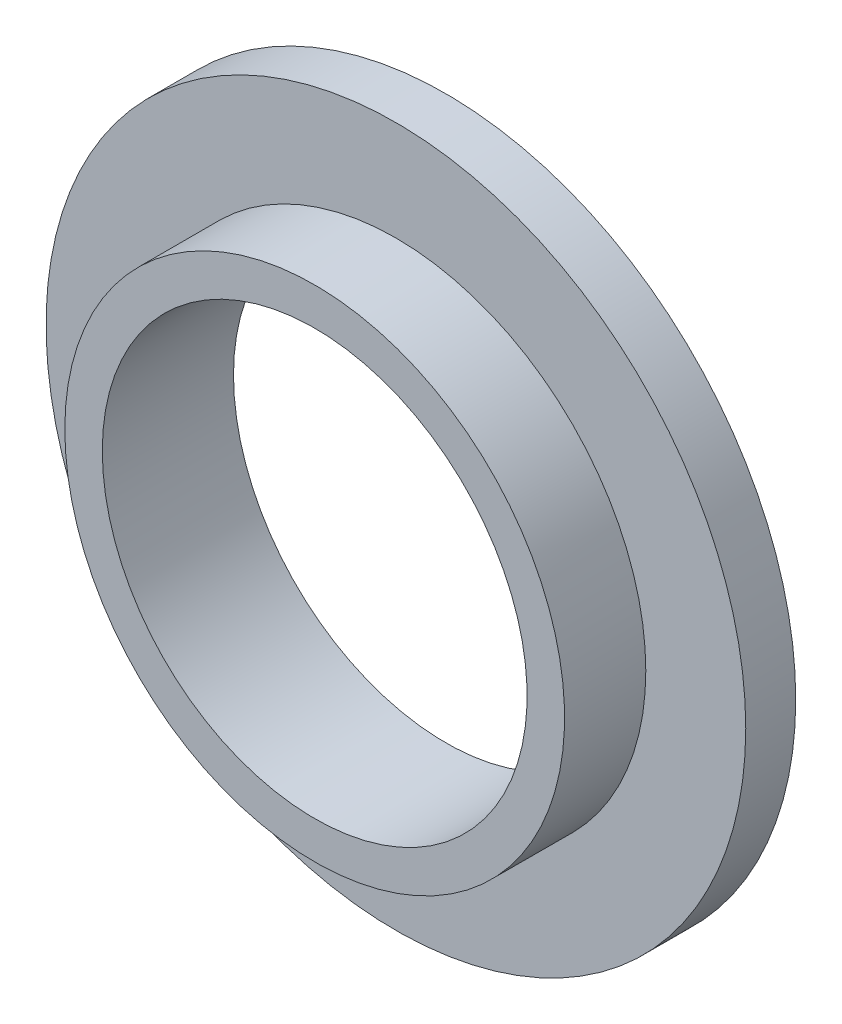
SolidWorks part; units mm, degrees
ref_plane "前视基准面" through (0, 0, 0) normal (0, 0, 1) x (1, 0, 0)
ref_plane "上视基准面" through (0, 0, 0) normal (0, 1, 0) x (1, 0, 0)
ref_plane "右视基准面" through (0, 0, 0) normal (1, 0, 0) x (0, 0, -1)
sketch "草图1" plane through (0, 0, 0) normal (0, 0, 1) x (1, 0, 0)
  circle A0 centre (0, 0) radius 8.5
  circle A1 centre (0, 0) radius 14
  dimension "D1" = 17
  dimension "D2" = 28
extrude "拉伸1" add sketch "草图1" along normal blind 2
sketch "草图2" plane through (0, 0, 2) normal (0, 0, 1) x (1, 0, 0)
  circle A0 centre (0, 0) radius 8.5 construction
  circle A1 centre (0, 0) radius 8.5
  circle A2 centre (0, 0) radius 10
  dimension "D1" = 20
extrude "拉伸2" add sketch "草图2" along normal up to surface (3.25 mm away)
